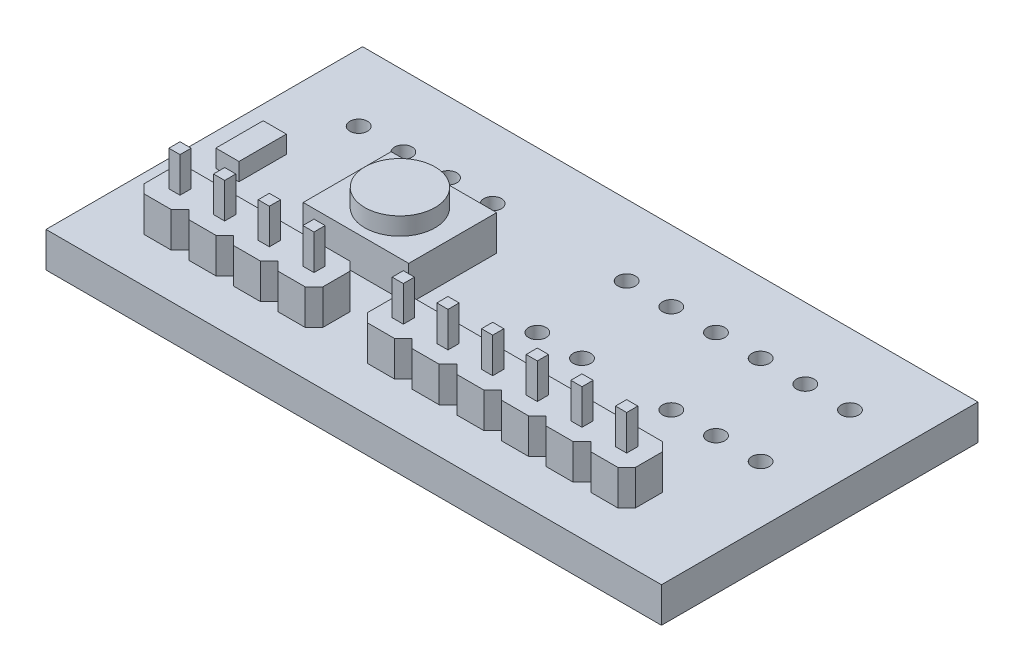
SolidWorks part; units mm, degrees
ref_plane "Front Plane" through (0, 0, 0) normal (0, 0, 1) x (1, 0, 0)
ref_plane "Top Plane" through (0, 0, 0) normal (0, 1, 0) x (1, 0, 0)
ref_plane "Right Plane" through (0, 0, 0) normal (1, 0, 0) x (0, 0, -1)
sketch "Sketch1" plane through (0, 0, 0) normal (0, 1, 0) x (1, 0, 0)
  line L0 (3.81, 3.81) -> (6.35, 3.81) construction
  line L1 (0, 0) -> (35, 0)
  line L2 (0, 0) -> (0, 18)
  line L3 (0, 18) -> (35, 18)
  line L4 (35, 0) -> (35, 18)
  line L5 (3.81, 3.81) -> (3.81, 6.35) construction
  circle A0 centre (3.81, 3.81) radius 0.5
  circle A1 centre (6.35, 3.81) radius 0.5
  circle A2 centre (8.89, 3.81) radius 0.5
  circle A3 centre (11.43, 3.81) radius 0.5
  circle A4 centre (13.97, 3.81) radius 0.5
  circle A5 centre (16.51, 3.81) radius 0.5
  circle A6 centre (19.05, 3.81) radius 0.5
  circle A7 centre (21.59, 3.81) radius 0.5
  circle A8 centre (24.13, 3.81) radius 0.5
  circle A9 centre (26.67, 3.81) radius 0.5
  circle A10 centre (29.21, 3.81) radius 0.5
  circle A11 centre (31.75, 3.81) radius 0.5
  circle A12 centre (6.35, 6.35) radius 0.5
  circle A13 centre (8.89, 6.35) radius 0.5
  circle A14 centre (11.43, 6.35) radius 0.5
  circle A15 centre (13.97, 6.35) radius 0.5
  circle A16 centre (16.51, 6.35) radius 0.5
  circle A17 centre (19.05, 6.35) radius 0.5
  circle A18 centre (21.59, 6.35) radius 0.5
  circle A19 centre (24.13, 6.35) radius 0.5
  circle A20 centre (26.67, 6.35) radius 0.5
  circle A21 centre (29.21, 6.35) radius 0.5
  circle A22 centre (31.75, 6.35) radius 0.5
  circle A23 centre (6.35, 8.89) radius 0.5
  circle A24 centre (8.89, 8.89) radius 0.5
  circle A25 centre (11.43, 8.89) radius 0.5
  circle A26 centre (13.97, 8.89) radius 0.5
  circle A27 centre (16.51, 8.89) radius 0.5
  circle A28 centre (19.05, 8.89) radius 0.5
  circle A29 centre (21.59, 8.89) radius 0.5
  circle A30 centre (24.13, 8.89) radius 0.5
  circle A31 centre (26.67, 8.89) radius 0.5
  circle A32 centre (29.21, 8.89) radius 0.5
  circle A33 centre (31.75, 8.89) radius 0.5
  circle A34 centre (6.35, 11.43) radius 0.5
  circle A35 centre (8.89, 11.43) radius 0.5
  circle A36 centre (11.43, 11.43) radius 0.5
  circle A37 centre (13.97, 11.43) radius 0.5
  circle A38 centre (16.51, 11.43) radius 0.5
  circle A39 centre (19.05, 11.43) radius 0.5
  circle A40 centre (21.59, 11.43) radius 0.5
  circle A41 centre (24.13, 11.43) radius 0.5
  circle A42 centre (26.67, 11.43) radius 0.5
  circle A43 centre (29.21, 11.43) radius 0.5
  circle A44 centre (31.75, 11.43) radius 0.5
  circle A45 centre (6.35, 13.97) radius 0.5
  circle A46 centre (8.89, 13.97) radius 0.5
  circle A47 centre (11.43, 13.97) radius 0.5
  circle A48 centre (13.97, 13.97) radius 0.5
  circle A49 centre (16.51, 13.97) radius 0.5
  circle A50 centre (19.05, 13.97) radius 0.5
  circle A51 centre (21.59, 13.97) radius 0.5
  circle A52 centre (24.13, 13.97) radius 0.5
  circle A53 centre (26.67, 13.97) radius 0.5
  circle A54 centre (29.21, 13.97) radius 0.5
  circle A55 centre (31.75, 13.97) radius 0.5
  circle A56 centre (3.81, 6.35) radius 0.5
  circle A57 centre (3.81, 8.89) radius 0.5
  circle A58 centre (3.81, 11.43) radius 0.5
  circle A59 centre (3.81, 13.97) radius 0.5
  dimension "D3" = 1
  dimension "D1" = 35
  dimension "D2" = 18
  dimension "D4" = 3.81
  dimension "D5" = 3.81
  dimension "D7" = 2.54
  dimension "D8" = 2.54
  dimension "D6" = 12
extrude "Board" add sketch "Sketch1" along normal blind 2
sketch "Sketch2" plane through (0, 2, 0) normal (0, 1, 0) x (1, 0, 0)
  line L1 (7.9862, 11.6401) -> (13.9862, 11.6401)
  line L2 (7.9862, 11.6401) -> (7.9862, 6.6401)
  line L3 (7.9862, 6.6401) -> (13.9862, 6.6401)
  line L4 (13.9862, 11.6401) -> (13.9862, 6.6401)
  dimension "D1" = 6
  dimension "D2" = 5
extrude "Button base" add sketch "Sketch2" along normal blind 2
sketch "Sketch3" plane through (0, 2, 0) normal (0, 1, 0) x (1, 0, 0)
  line L1 (1.823, 10.5273) -> (3.1409, 10.5273)
  line L2 (1.823, 10.5273) -> (1.823, 7.8327)
  line L3 (1.823, 7.8327) -> (3.1409, 7.8327)
  line L4 (3.1409, 10.5273) -> (3.1409, 7.8327)
extrude "Resistor" add sketch "Sketch3" along normal blind 1
sketch "Sketch4" plane through (0, 4, 0) normal (0, 1, 0) x (1, 0, 0)
  line L0 (13.9862, 11.6401) -> (7.9862, 11.6401) construction
  line L1 (13.9862, 6.6401) -> (13.9862, 11.6401) construction
  circle A0 centre (10.9862, 9.1401) radius 2
  point P5 (10.9862, 11.6401)
  point P8 (13.9862, 9.1401)
extrude "Button" add sketch "Sketch4" along normal blind 1
sketch "Sketch5" plane through (0, 2, 0) normal (0, 1, 0) x (1, 0, 0)
  line L0 (0, 0) -> (35, 0) construction
  line L1 (3.04, 5.08) -> (4.58, 5.08)
  line L2 (2.54, 4.58) -> (2.54, 3.04)
  line L3 (3.04, 2.54) -> (4.58, 2.54)
  line L4 (5.08, 4.58) -> (5.08, 3.04)
  line L5 (0, 18) -> (0, 0) construction
  line L6 (2.54, 3.04) -> (3.04, 2.54)
  line L7 (2.54, 4.58) -> (3.04, 5.08)
  line L8 (4.58, 5.08) -> (5.08, 4.58)
  line L9 (4.58, 2.54) -> (5.08, 3.04)
  point P0 (2.54, 5.08)
  point P1 (5.08, 2.54)
  point P2 (2.54, 2.54)
  point P3 (5.08, 5.08)
  dimension "D1" = 2.54
  dimension "D2" = 2.54
  dimension "D3" = 2.54
  dimension "D4" = 2.54
extrude "Header block" add sketch "Sketch5" along normal blind 2
sketch "Sketch6" plane through (0, 4, 0) normal (0, 1, 0) x (1, 0, 0)
  line L0 (3.04, 2.54) -> (4.58, 2.54) construction
  line L1 (3.4925, 3.4925) -> (4.1275, 3.4925)
  line L2 (3.4925, 3.4925) -> (3.4925, 4.1275)
  line L3 (3.4925, 4.1275) -> (4.1275, 4.1275)
  line L4 (4.1275, 3.4925) -> (4.1275, 4.1275)
  line L5 (5.08, 3.04) -> (5.08, 4.58) construction
  point P6 (3.81, 2.54)
  point P7 (3.81, 3.4925)
  point P10 (5.08, 3.81)
  point P11 (4.1275, 3.81)
  dimension "D1" = 0.635
extrude "Pin" add sketch "Sketch6" along normal blind 2 and the other way blind 7
pattern_linear "LPattern1" count 11 spacing 2.54 along (1, 0, 0) of "Header block", "Pin"
